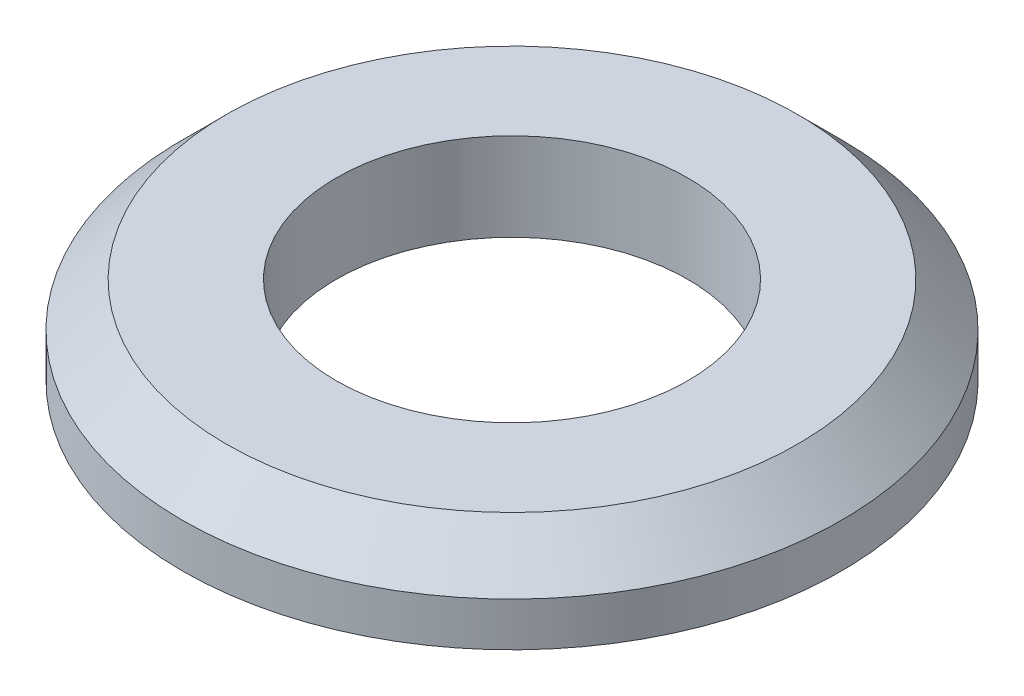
SolidWorks part; units mm, degrees
ref_plane "Front" through (0, 0, 0) normal (0, 0, 1) x (1, 0, 0)
ref_plane "Top" through (0, 0, 0) normal (0, 1, 0) x (1, 0, 0)
ref_plane "Right" through (0, 0, 0) normal (1, 0, 0) x (0, 0, -1)
sketch "Sketch1" plane through (0, 0, 0) normal (0, 1, 0) x (1, 0, 0)
  circle A0 centre (0, 0) radius 3.2
  circle A1 centre (0, 0) radius 6
extrude "Extrude1" add sketch "Sketch1" along normal blind 1.6
chamfer "Chamfer1" distance 0.8 angle 45 1 edges at (0, 1.6, 6)
